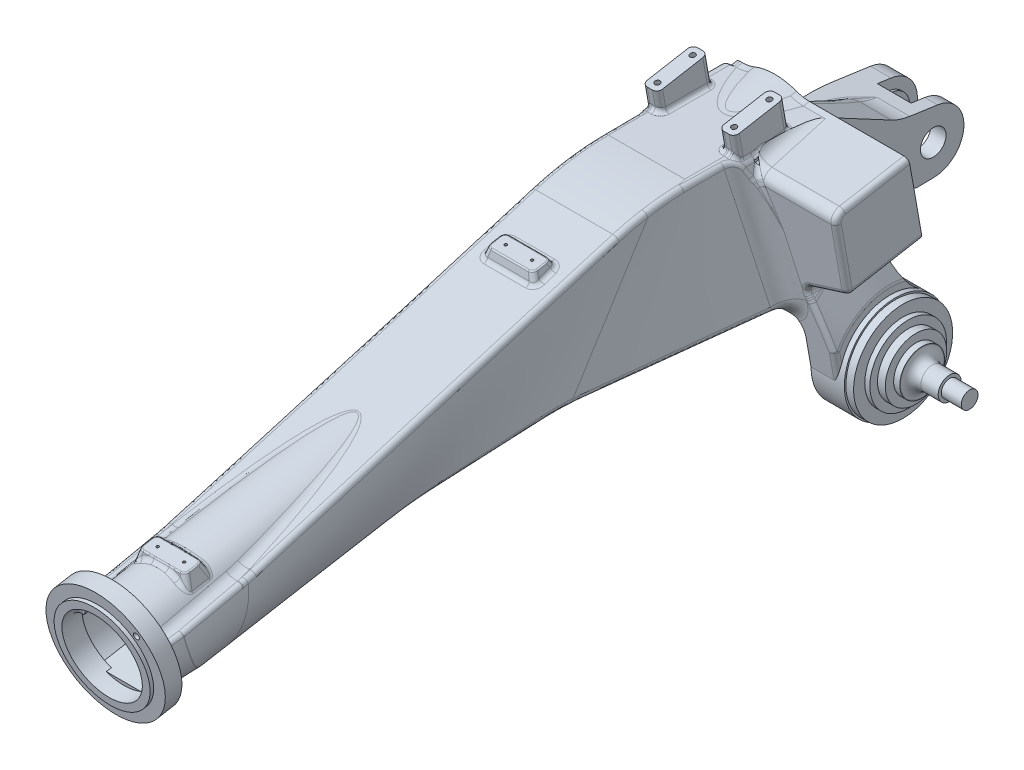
SolidWorks part; units mm, degrees
ref_plane "Piano1 (Front/Back)" through (0, 0, 0) normal (0, 0, 1) x (1, 0, 0)
ref_plane "Piano2 (Top/Bottom)" through (0, 0, 0) normal (0, 1, 0) x (1, 0, 0)
ref_plane "Piano3 (Left/Right)" through (0, 0, 0) normal (1, 0, 0) x (0, 0, -1)
imported_body "Importato1"
sketch "Schizzo1" plane through (0, 8.5886, -48.7081) normal (0, 0.1736, -0.9848) x (-1, 0, 0)
  circle A0 centre (0, 278.9298) radius 65 construction
  circle A1 centre (0, 278.9298) radius 65
  circle A2 centre (58.3363, 337.2661) radius 6 construction
  circle A3 centre (58.3363, 337.2661) radius 6
  circle A4 centre (-182.2, 278.9298) radius 65 construction
  circle A5 centre (-182.2, 278.9298) radius 65
  circle A6 centre (-123.8637, 337.2661) radius 6 construction
  circle A7 centre (-123.8637, 337.2661) radius 6
extrude "Taglio-Estrusione1" cut sketch "Schizzo1" against normal blind 8
sketch "Schizzo2" plane through (0, -224.9682, 1275.8583) normal (0, -0.1736, 0.9848) x (1, 0, 0)
  circle A0 centre (72.832, 351.7418) radius 6 construction
  circle A1 centre (72.832, 351.7418) radius 6
extrude "Taglio-Estrusione2" cut sketch "Schizzo2" against normal blind 10
hole_wizard "M12 Foro filettato profondo1" positions "Schizzo5" profile "Schizzo4" tap size "M12" standard "ISO"
sketch "Schizzo5" plane through (0, 418.9322, 73.869) normal (0, 0.9848, 0.1736) x (-1, 0, 0)
  point P1 (75, 98.0024)
  point P4 (-75, 28)
  point P7 (-75, 98.0024)
  point P10 (75, 28)
sketch "Schizzo4" plane through (-75, 401.9142, 170.3826) normal (1, 0, 0) x (0, -0.1736, 0.9848)
  line L0 (0, 0) -> (0, 35.8144)
  line L1 (0, 35.8144) -> (5.1, 32.75)
  line L2 (5.1, 32.75) -> (5.1, 0)
  line L5 (5.1, 0) -> (0, 0)
  line L10 (0, 35.8144) -> (-5.1, 32.75) construction
  line L11 (0, -6.35) -> (0, 107.95) construction
  dimension "Tap Drill Dia." = 10.2
  dimension "Tap Drill Depth" = 32.75
  dimension "Drill Angle" = 118
hole_wizard "M6 Foro filettato profondo1" positions "Schizzo7" profile "Schizzo6" tap size "M6" standard "ISO"
sketch "Schizzo7" plane through (0, 403.1595, 71.0879) normal (0, 0.9848, 0.1736) x (-1, 0, 0)
  point P1 (26, 451.7815)
  point P4 (-26, 451.7815)
sketch "Schizzo6" plane through (-26, 324.7084, 516.0059) normal (1, 0, 0) x (0, -0.1736, 0.9848)
  line L0 (0, 0) -> (0, 18.5022)
  line L1 (0, 18.5022) -> (2.5, 17)
  line L2 (2.5, 17) -> (2.5, 0)
  line L5 (2.5, 0) -> (0, 0)
  line L10 (0, 18.5022) -> (-2.5, 17) construction
  line L11 (0, -6.35) -> (0, 107.95) construction
  dimension "Tap Drill Dia." = 5
  dimension "Tap Drill Depth" = 17
  dimension "Drill Angle" = 118
hole_wizard "M6 Foro filettato profondo2" positions "Schizzo9" profile "Schizzo8" tap size "M6" standard "ISO"
sketch "Schizzo9" plane through (0, 353.9191, 62.4055) normal (0, 0.9848, 0.1736) x (-1, 0, 0)
  point P1 (-26, 1151.8265)
  point P4 (26, 1151.8265)
sketch "Schizzo8" plane through (26, 153.9065, 1196.7331) normal (1, 0, 0) x (0, -0.1736, 0.9848)
  line L0 (0, 0) -> (0, 18.5022)
  line L1 (0, 18.5022) -> (2.5, 17)
  line L2 (2.5, 17) -> (2.5, 0)
  line L5 (2.5, 0) -> (0, 0)
  line L10 (0, 18.5022) -> (-2.5, 17) construction
  line L11 (0, -6.35) -> (0, 107.95) construction
  dimension "Tap Drill Dia." = 5
  dimension "Tap Drill Depth" = 17
  dimension "Drill Angle" = 118
hole_wizard "M8 Foro filettato profondo1" positions "Schizzo11" profile "Schizzo10" tap size "M8" standard "ISO"
sketch "Schizzo11" plane through (-90, 0, 0) normal (-1, 0, 0) x (0, 0, 1)
  point P1 (138.6975, 371.9612)
  point P4 (101.7672, 378.473)
  point P9 (143.0387, 396.5814)
sketch "Schizzo10" plane through (-90, 371.9612, 138.6975) normal (0, 1, 0) x (0, 0, 1)
  line L0 (0, 0) -> (0, 24.2929)
  line L1 (0, 24.2929) -> (3.4, 22.25)
  line L2 (3.4, 22.25) -> (3.4, 0)
  line L5 (3.4, 0) -> (0, 0)
  line L10 (0, 24.2929) -> (-3.4, 22.25) construction
  line L11 (0, -6.35) -> (0, 107.95) construction
  dimension "Tap Drill Dia." = 6.8
  dimension "Tap Drill Depth" = 22.25
  dimension "Drill Angle" = 118
